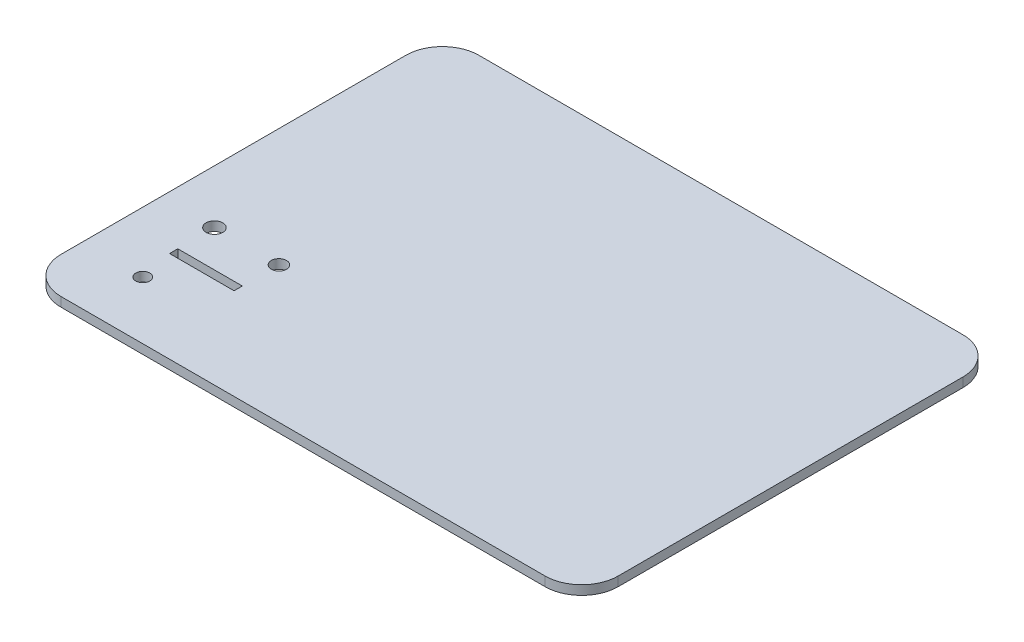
SolidWorks part; units mm, degrees
ref_plane "Front Plane" through (0, 0, 0) normal (0, 0, 1) x (1, 0, 0)
ref_plane "Top Plane" through (0, 0, 0) normal (0, 1, 0) x (1, 0, 0)
ref_plane "Right Plane" through (0, 0, 0) normal (1, 0, 0) x (0, 0, -1)
sketch "Sketch1" plane through (0, 0, 0) normal (0, 1, 0) x (1, 0, 0)
  line L1 (10, 0) -> (142.4, 0)
  line L2 (0, 10) -> (0, 104.3)
  line L3 (10, 114.3) -> (142.4, 114.3)
  line L4 (152.4, 10) -> (152.4, 104.3)
  arc A0 (0, 104.3) -> (10, 114.3) centre (10, 104.3) cw
  arc A1 (10, 0) -> (0, 10) centre (10, 10) cw
  arc A2 (152.4, 10) -> (142.4, 0) centre (142.4, 10) cw
  arc A3 (142.4, 114.3) -> (152.4, 104.3) centre (142.4, 104.3) cw
  point P6 (0, 114.3)
  point P9 (0, 0)
  point P12 (152.4, 0)
  dimension "D3" = 10
  dimension "D1" = 152.4
  dimension "D2" = 114.3
extrude "Extrude1" add sketch "Sketch1" along normal blind 2.54
sketch "Sketch2" plane through (0, 2.54, 0) normal (0, 1, 0) x (-1, 0, 0)
  line L1 (-14.651, -25.0294) -> (-32.2919, -25.0294)
  line L2 (-14.651, -25.0294) -> (-14.651, -27.2826)
  line L3 (-14.651, -27.2826) -> (-32.2919, -27.2826)
  line L4 (-32.2919, -25.0294) -> (-32.2919, -27.2826)
  circle A0 centre (-16.5566, -15.7998) radius 1.9055
  circle A1 centre (-32.2919, -37.3052) radius 2.0872
  circle A2 centre (-14.651, -37.3052) radius 2.2805
extrude "Cut-Extrude1" cut sketch "Sketch2" against normal blind 2.54
